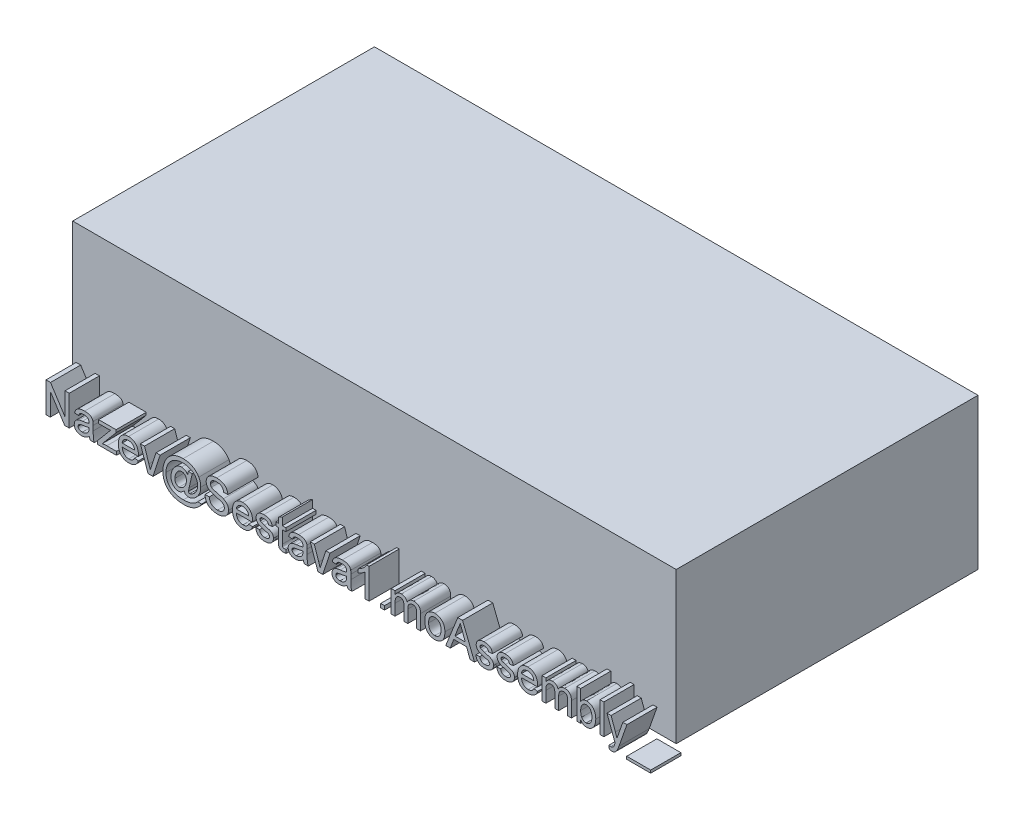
SolidWorks part; units mm, degrees
ref_plane "Přední rovina" through (0, 0, 0) normal (0, 0, 1) x (1, 0, 0)
ref_plane "Horní rovina" through (0, 0, 0) normal (0, 1, 0) x (1, 0, 0)
ref_plane "Pravá rovina" through (0, 0, 0) normal (1, 0, 0) x (0, 0, -1)
sketch "Skica1" plane through (0, 0, 0) normal (0, 1, 0) x (1, 0, 0)
  line L0 (0, 0) -> (8973.0871, 0) construction
  line L1 (0, 0) -> (0, -8973.0871) construction
  line L3 (-10, 5) -> (10, 5)
  line L4 (-10, 5) -> (-10, -5)
  line L5 (-10, -5) -> (10, -5)
  line L6 (10, 5) -> (10, -5)
  dimension "D1" = 10
  dimension "D2" = 20
extrude "Přidat vysunutím1" add sketch "Skica1" along normal blind 5
sketch "Skica2" plane through (0, 0, 5) normal (0, 0, 1) x (1, 0, 0)
  text T0 "Nazev@Sestava1.moAssembly_c" font "Arial" height 1
extrude "Přidat vysunutím2" add sketch "Skica2" along normal blind 1
